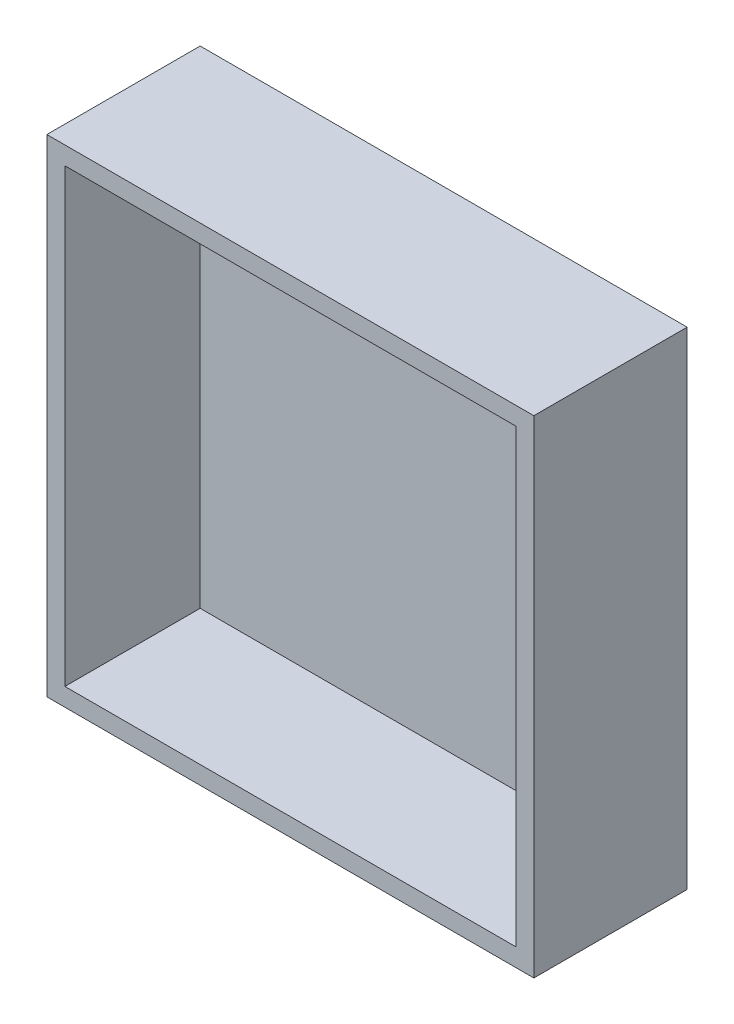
SolidWorks part; units mm, degrees
ref_plane "Płaszczyzna przednia" through (0, 0, 0) normal (0, 0, 1) x (1, 0, 0)
ref_plane "Płaszczyzna górna" through (0, 0, 0) normal (0, 1, 0) x (1, 0, 0)
ref_plane "Płaszczyzna prawa" through (0, 0, 0) normal (1, 0, 0) x (0, 0, -1)
sketch "Szkic1" plane through (0, 0, 0) normal (0, 0, 1) x (1, 0, 0)
  line L1 (25, -25) -> (-25, -25)
  line L2 (25, -25) -> (25, 25)
  line L3 (25, 25) -> (-25, 25)
  line L4 (-25, -25) -> (-25, 25)
  line L5 (25, -25) -> (-25, 25) construction
  line L6 (25, 25) -> (-25, -25) construction
  point P0 (0, 0)
  dimension "D1" = 50
  dimension "D2" = 50
extrude "Dodanie-wyciągnięcie1" add sketch "Szkic1" along normal blind 15
shell "Skorupa1" thickness 2
